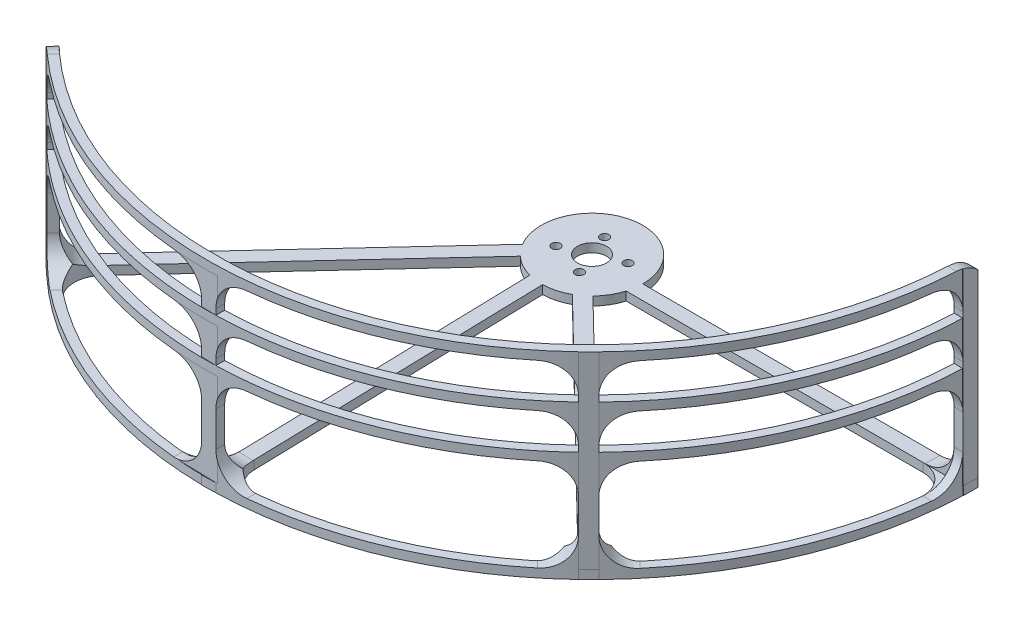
SolidWorks part; units mm, degrees
ref_plane "前视基准面" through (0, 0, 0) normal (0, 0, 1) x (1, 0, 0)
ref_plane "上视基准面" through (0, 0, 0) normal (0, 1, 0) x (1, 0, 0)
ref_plane "右视基准面" through (0, 0, 0) normal (1, 0, 0) x (0, 0, -1)
other "Configuration Table"
sketch "草图8" plane through (0, 0, 0) normal (0, 1, 0) x (1, 0, 0)
  circle A0 centre (0, 0) radius 17.5
  circle A1 centre (0, 0) radius 5
extrude "凸台-拉伸5" add sketch "草图8" along normal blind 3
sketch "草图9" plane through (0, 0, 0) normal (0, -1, 0) x (1, 0, 0)
  line L0 (-91.9239, 91.9239) -> (-94.0452, 94.0452)
  line L1 (130, 0) -> (133, 0)
  arc A0 (130, 0) -> (-91.9239, 91.9239) centre (0, 0) ccw
  arc A1 (133, 0) -> (-94.0452, 94.0452) centre (0, 0) ccw
  dimension "D1" = 3
sketch "草图10" plane through (0, 0, 0) normal (0, 1, 0) x (1, 0, 0)
  line L0 (133, 0) -> (15.9247, 0)
  line L1 (133, 0) -> (133, -5)
  line L2 (15.9247, 0) -> (15.9247, -5)
  line L3 (133, -5) -> (15.9247, -5)
  line L4 (95.2412, -92.8338) -> (11.4036, -11.1154)
  line L5 (95.2412, -92.8338) -> (91.7512, -96.4143)
  line L6 (91.7512, -96.4143) -> (7.9137, -14.6959)
  line L7 (11.4036, -11.1154) -> (7.9137, -14.6959)
  line L8 (3.4042, -132.9564) -> (0.4076, -15.9195)
  line L9 (3.4042, -132.9564) -> (-1.5942, -133.0844)
  line L10 (-1.5942, -133.0844) -> (-4.5908, -16.0474)
  line L11 (0.4076, -15.9195) -> (-4.5908, -16.0474)
  line L12 (-90.3657, -97.5861) -> (-10.8199, -11.6844)
  line L13 (-90.3657, -97.5861) -> (-94.0343, -94.1889)
  line L14 (-94.0343, -94.1889) -> (-14.4885, -8.2872)
  line L15 (-10.8199, -11.6844) -> (-14.4885, -8.2872)
  point P22 (0, 0)
  dimension "D1" = 5
  dimension "D2" = 4
extrude "凸台-拉伸7" add sketch "草图9" against normal blind 3
sketch "草图11" plane through (0, 0, 0) normal (1, 0, 0) x (0, 0, -1)
  line L0 (0, 0) -> (0, 50) construction
pattern_linear "阵列(线性)6" count 2 spacing 50 along (0, 1, 0) of "凸台-拉伸7"
pattern_linear "阵列(线性)8" count 2 spacing 35 along (0, 1, 0) of "凸台-拉伸7"
pattern_linear "阵列(线性)9" count 2 spacing 65 along (0, 1, 0) of "凸台-拉伸7"
extrude "凸台-拉伸9" add sketch "草图10" along normal blind 3
sketch "草图12" plane through (0, 3, 0) normal (0, 1, 0) x (1, 0, 0)
  line L0 (-91.9239, -91.9239) -> (-88.2623, -95.3146)
  line L1 (-91.9239, -91.9239) -> (-94.0304, -94.1987)
  line L2 (-88.2623, -95.3146) -> (-90.3687, -97.5894)
  line L3 (-94.0304, -94.1987) -> (-90.3687, -97.5894)
  line L4 (-88.3274, -95.3849) -> (-11.8902, -12.8403) construction
  line L6 (-1.6771, -129.8438) -> (3.3274, -129.9574)
  line L7 (-1.6771, -129.8438) -> (-1.7447, -132.8176)
  line L8 (3.3274, -129.9574) -> (3.2599, -132.9312)
  line L9 (-1.7447, -132.8176) -> (3.2599, -132.9312)
  line L10 (-4.5691, -16.893) -> (-1.6734, -129.9892) construction
  line L11 (89.534, -94.2532) -> (93.024, -90.6727)
  line L12 (89.534, -94.2532) -> (91.7599, -96.4229)
  line L13 (93.024, -90.6727) -> (95.2499, -92.8424)
  line L14 (91.7599, -96.4229) -> (95.2499, -92.8424)
  line L15 (93.0929, -90.7398) -> (12.5317, -12.215) construction
  line L17 (129.7901, -5) -> (130, 0)
  line L18 (129.7901, -5) -> (132.9893, -5.1343)
  line L19 (130, 0) -> (133.1992, -0.1343)
  line L20 (132.9893, -5.1343) -> (133.1992, -0.1343)
  line L21 (16.7705, -5) -> (129.9038, -5) construction
  arc A1 (3.3274, -129.9574) -> (89.534, -94.2532) centre (0, 0) ccw construction
  arc A2 (-91.9239, -91.9239) -> (130, 0) centre (0, 0) ccw construction
extrude "凸台-拉伸10" add sketch "草图12" along normal up to surface (65 mm away)
fillet "圆角1" radius 10 6 edges at (-1.7126, 3, 131.4034) (3.2936, 3, 131.4443) (90.6089, 3, 95.301) (94.167, 3, 91.7868) (131.4023, 3, 5.0677) (-89.3465, 3, 96.4855)
fillet "圆角2" radius 10 4 edges at (0.8251, 3, 129.9006) (91.279, 3, 92.463) (-90.0931, 3, 93.6192) (129.895, 3, 2.5)
fillet "圆角3" radius 10 4 edges at (93.0929, 6.5, 90.7398) (89.534, 6.5, 94.2532) (-88.3274, 6.5, 95.3849) (3.3274, 6.5, 129.9574)
fillet "圆角5" radius 10 1 edges at (-1.6734, 1.5, 129.9892)
fillet "圆角6" radius 10 1 edges at (129.9038, 1.5, 5)
fillet "圆角7" radius 10 18 edges at (-1.7126, 65, 131.4034) (-1.7126, 50, 131.4034) (-1.7126, 35, 131.4034) (94.167, 35, 91.7868) (94.167, 50, 91.7868) (94.167, 65, 91.7868) (-89.3465, 65, 96.4855) (-89.3465, 50, 96.4855) (-89.3465, 35, 96.4855) (3.2936, 65, 131.4443) (3.2936, 50, 131.4443) (3.2936, 35, 131.4443) (90.6089, 35, 95.301) (90.6089, 50, 95.301) (90.6089, 65, 95.301) (131.4023, 65, 5.0677) (131.4023, 50, 5.0677) (131.4023, 35, 5.0677)
sketch "草图13" plane through (0, 3, 0) normal (0, 1, 0) x (1, 0, 0)
  line L0 (0.905, -133.0204) -> (93.5049, -94.6326) construction
  line L1 (-1.5942, -133.0844) -> (3.4042, -132.9564) construction
  line L2 (95.2499, -92.8424) -> (91.7599, -96.4229) construction
  line L3 (47.205, -113.8265) -> (-6.7038, 16.1651) construction
  line L5 (-16.1651, -6.7038) -> (16.1651, 6.7038) construction
  arc A0 (17.5, 0) -> (-15.0632, -8.9078) centre (0, 0) ccw construction
sketch "草图14" plane through (0, 3, 0) normal (0, 1, 0) x (1, 0, 0)
  line L0 (47.205, -113.8265) -> (-6.7038, 16.1651) construction
  line L1 (-16.1651, -6.7038) -> (16.1651, 6.7038) construction
  circle A0 centre (-3.0646, 7.3897) radius 1.5
  circle A1 centre (3.0646, -7.3897) radius 1.5
  circle A2 centre (8.7753, 3.6392) radius 1.5
  circle A3 centre (-8.7753, -3.6392) radius 1.5
  dimension "D1" = 8
  dimension "D2" = 8
  dimension "D3" = 9.5
  dimension "D4" = 9.5
extrude "切除-拉伸1" cut sketch "草图14" against normal blind 3
fillet "圆角9" radius 10 2 edges at (-92.9845, 68, 92.9845) (131.5, 68, 0)
